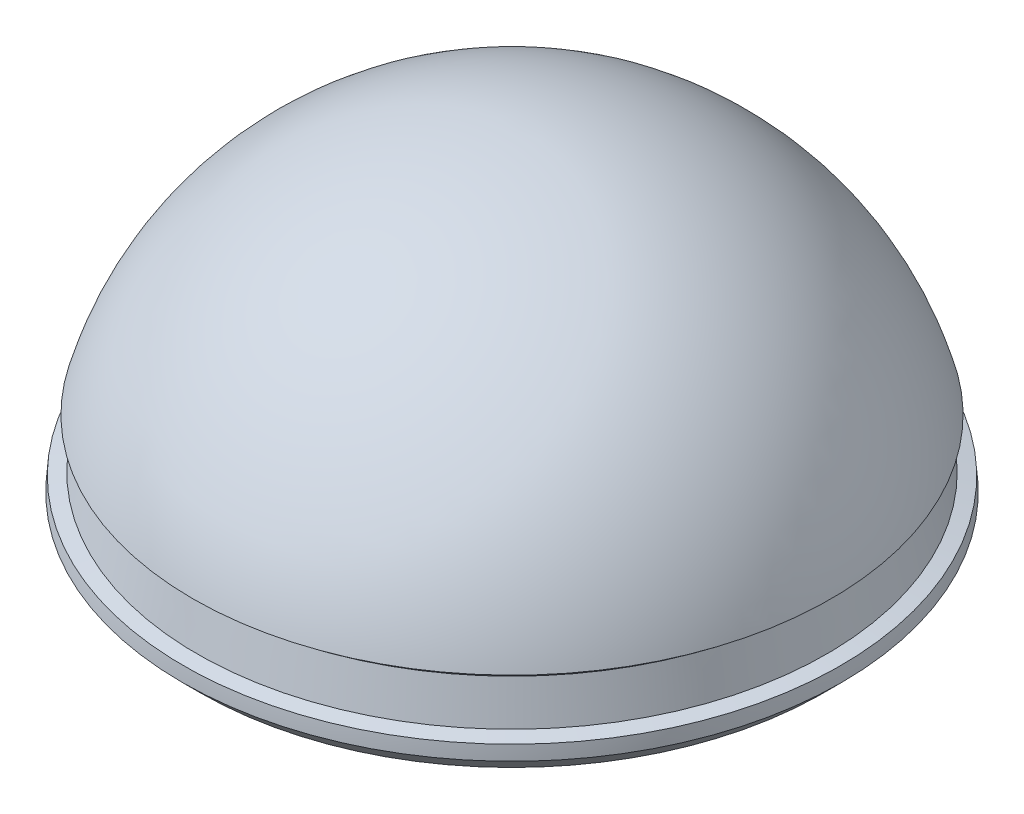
SolidWorks part; units mm, degrees
ref_plane "Plan de face" through (0, 0, 0) normal (0, 0, 1) x (1, 0, 0)
ref_plane "Plan de dessus" through (0, 0, 0) normal (0, 1, 0) x (1, 0, 0)
ref_plane "Plan de droite" through (0, 0, 0) normal (1, 0, 0) x (0, 0, -1)
sketch "Esquisse1" plane through (0, 0, 0) normal (1, 0, 0) x (0, 0, -1)
  line L0 (35, 0) -> (31, 0)
  line L1 (0, 35) -> (0, 18)
  line L2 (0, 18) -> (6, 18)
  line L3 (6, 18) -> (6, 30.4138)
  arc A0 (31, 0) -> (6, 30.4138) centre (0, 0) ccw
  arc A1 (0, 35) -> (35, 0) centre (0, 0) cw
  dimension "D1" = 4
  dimension "D2" = 18
  dimension "D3" = 6
  dimension "D4" = 35
revolve "Révolution1" add sketch "Esquisse1" angle 360 about L1
sketch "Esquisse2" plane through (0, 0, 0) normal (1, 0, 0) x (0, 0, -1)
  line L0 (32.4996, 8.0243) -> (37.2917, 11.7738)
  line L1 (33.3679, 3.7695) -> (32.4996, 8.0243)
  line L2 (33.3679, 3.7695) -> (40.8257, 2.0553)
  line L3 (0, 0) -> (0, 22.8295) construction
  line L4 (40.8257, 2.0553) -> (37.2917, 11.7738)
revolve "Enlèvement de matière-Révolution2" cut sketch "Esquisse2" angle 360 about L3
chamfer "Chanfrein1" distance 2 angle 45 1 edges at (0, 0, 35)
sketch "Esquisse3" plane through (0, 18, 0) normal (0, -1, 0) x (1, 0, 0)
  circle A0 centre (0, 0) radius 2.75
  dimension "D1" = 5.5
extrude "Enlèv. mat.-Extru.1" cut sketch "Esquisse3" against normal blind 6
